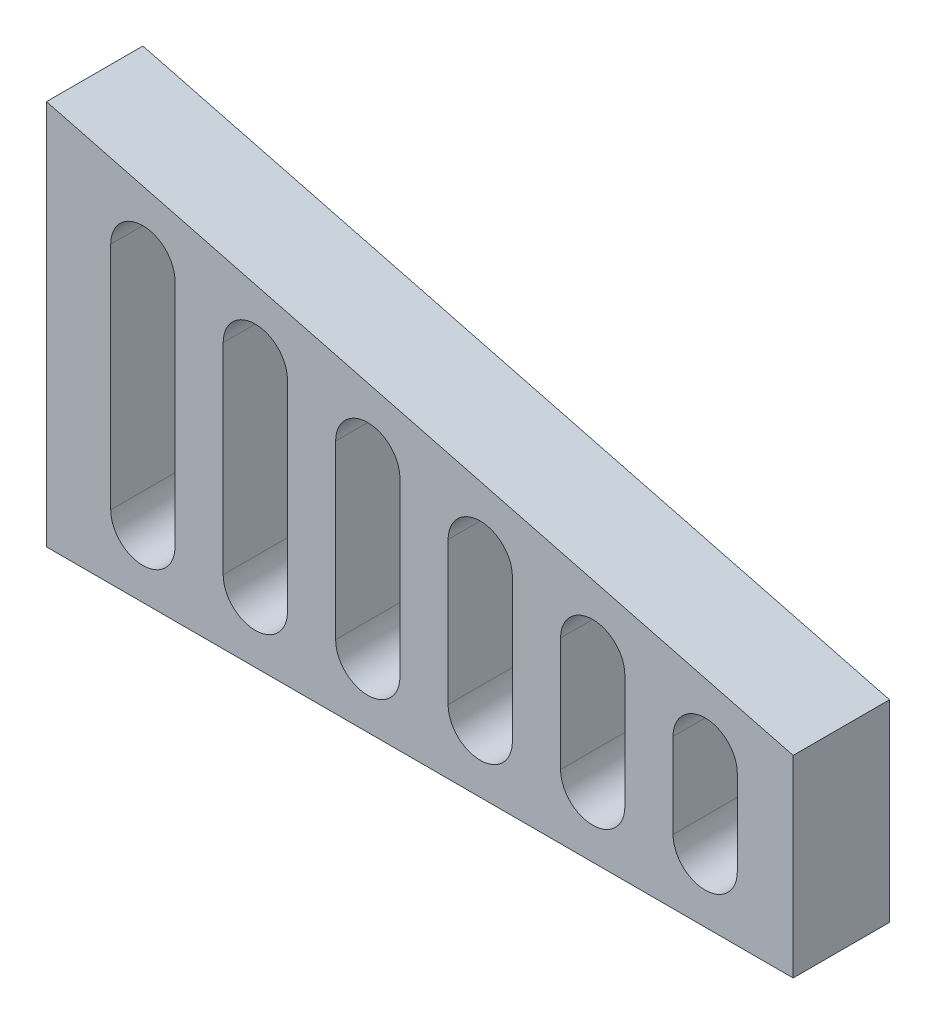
SolidWorks part; units mm, degrees
ref_plane "Front Plane" through (0, 0, 0) normal (0, 0, 1) x (1, 0, 0)
ref_plane "Top Plane" through (0, 0, 0) normal (0, 1, 0) x (1, 0, 0)
ref_plane "Right Plane" through (0, 0, 0) normal (1, 0, 0) x (0, 0, -1)
sketch "Sketch1" plane through (0, 0, 0) normal (0, 0, -1) x (1, 0, 0)
  line L1 (0, -38.1) -> (73.7803, -19.05)
  line L2 (0, -38.1) -> (0, 0)
  line L3 (0, 0) -> (73.7803, 0)
  line L4 (73.7803, -19.05) -> (73.7803, 0)
  dimension "D1" = 76.2
  dimension "D2" = 38.1
  dimension "D3" = 19.05
extrude "Extrude1" add sketch "Sketch1" along normal blind 9.525
sketch "Sketch2" plane through (0, 0, -9.525) normal (0, 0, -1) x (1, 0, 0)
  line L2 (73.7803, -3.175) -> (0, -3.175)
  line L3 (73.7803, -3.175) -> (0, -3.175) construction
  line L4 (6.35, -6.35) -> (6.35, -29.0824)
  line L5 (-0.7937, -35.0258) -> (72.9866, -15.9758)
  line L6 (0, -34.8209) -> (73.7803, -15.7709) construction
  line L7 (12.7, -6.35) -> (12.7, -29.0824)
  line L8 (0, 0) -> (0, -38.1) construction
  line L9 (73.7803, -19.05) -> (73.7803, 0) construction
  line L10 (0, 0) -> (0, -38.1) construction
  arc A0 (6.35, -6.35) -> (12.7, -6.35) centre (9.525, -6.35) cw
  arc A1 (12.7, -29.0824) -> (6.35, -29.0824) centre (9.525, -29.0824) cw
  dimension "D3" = 9.525
  dimension "D4" = 6.35
  dimension "offset" = 3.175
extrude "Cut-Extrude1" cut sketch "Sketch2" against normal through all
pattern_linear "LPattern1" count 6 spacing 11.1125 of "Cut-Extrude1"
